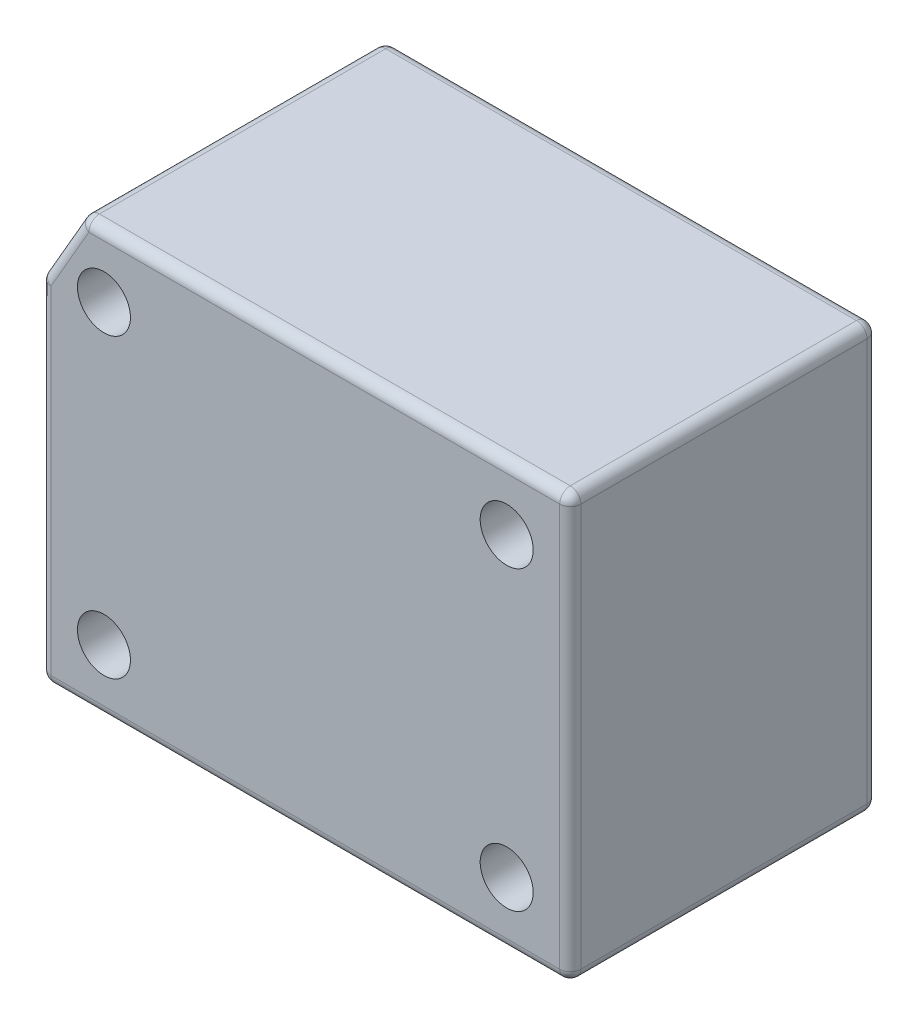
SolidWorks part; units mm, degrees
ref_plane "Plan de face" through (0, 0, 0) normal (0, 0, 1) x (1, 0, 0)
ref_plane "Plan de dessus" through (0, 0, 0) normal (0, 1, 0) x (1, 0, 0)
ref_plane "Plan de droite" through (0, 0, 0) normal (1, 0, 0) x (0, 0, -1)
sketch "Esquisse1" plane through (0, 0, 0) normal (0, 0, 1) x (1, 0, 0)
  line L1 (0, 0) -> (25, 0)
  line L2 (0, 0) -> (0, 20)
  line L3 (0, 20) -> (25, 20)
  line L4 (25, 0) -> (25, 20)
  dimension "D1" = 25
  dimension "D2" = 20
extrude "Boss.-Extru.1" add sketch "Esquisse1" along normal blind 14.5
chamfer "Chanfrein1" distance 2 angle 60 1 edges at (0, 20, 7.25)
fillet "Congé1" radius 0.5 4 edges at (25, 20, 7.25) (13.5, 20, 0) (2, 20, 7.25) (13.5, 20, 14.5)
fillet "Congé2" radius 0.5 5 edges at (24.8536, 19.8536, 0.1464) (24.8536, 19.8536, 14.3536) (25, 9.75, 0) (25, 0, 7.25) (25, 9.75, 14.5)
fillet "Congé3" radius 0.5 6 edges at (2.0387, 19.933, 0.25) (0, 0, 7.25) (0, 8.2679, 14.5) (0, 8.2679, 0) (0, 16.5359, 7.25) (0.8557, 18.0179, 0)
fillet "Congé4" radius 0.5 3 edges at (2.0387, 19.933, 14.25) (0.017, 16.5313, 14.1294) (1.1057, 18.451, 14.5)
fillet "Congé5" radius 0.5 6 edges at (0.1464, 0.1464, 0.1464) (24.8536, 0.1464, 0.1464) (0.1464, 0.1464, 14.3536) (24.8536, 0.1464, 14.3536) (12.5, 0, 0) (12.5, 0, 14.5)
sketch "Esquisse2" plane through (0, 0, 14.5) normal (0, 0, 1) x (1, 0, 0)
  line L0 (3, 21.1658) -> (3, -1.4039) construction
  line L1 (22, 21.1658) -> (22, -1.4039) construction
  line L2 (-1.4837, 3) -> (26.8276, 3) construction
  line L3 (-1.4837, 17) -> (27.6743, 17) construction
  line L4 (2.2887, 20) -> (24.5, 20) construction
  line L5 (0, 0.5) -> (0, 16.4019) construction
  line L6 (24.5, 0) -> (0.5, 0) construction
  line L7 (25, 19.5) -> (25, 0.5) construction
  circle A0 centre (3, 17) radius 0.75
  circle A1 centre (22, 17) radius 0.75
  circle A2 centre (22, 3) radius 0.75
  circle A3 centre (3, 3) radius 0.75
  dimension "D5" = 1.5
  dimension "D6" = 1.5
  dimension "D7" = 1.5
  dimension "D8" = 1.5
  dimension "D1" = 3
  dimension "D2" = 3
  dimension "D3" = 3
  dimension "D4" = 3
extrude "Enlèv. mat.-Extru.1" cut sketch "Esquisse2" against normal through all
sketch "Esquisse3" plane through (0, 0, 14.5) normal (0, 0, 1) x (1, 0, 0)
  circle A0 centre (3, 17) radius 1.25
  circle A1 centre (22, 17) radius 1.25
  circle A2 centre (3, 3) radius 1.25
  circle A3 centre (22, 3) radius 1.25
  dimension "D1" = 2.5
  dimension "D2" = 2.5
  dimension "D3" = 2.5
  dimension "D4" = 2.5
extrude "Enlèv. mat.-Extru.2" cut sketch "Esquisse3" against normal blind 5
